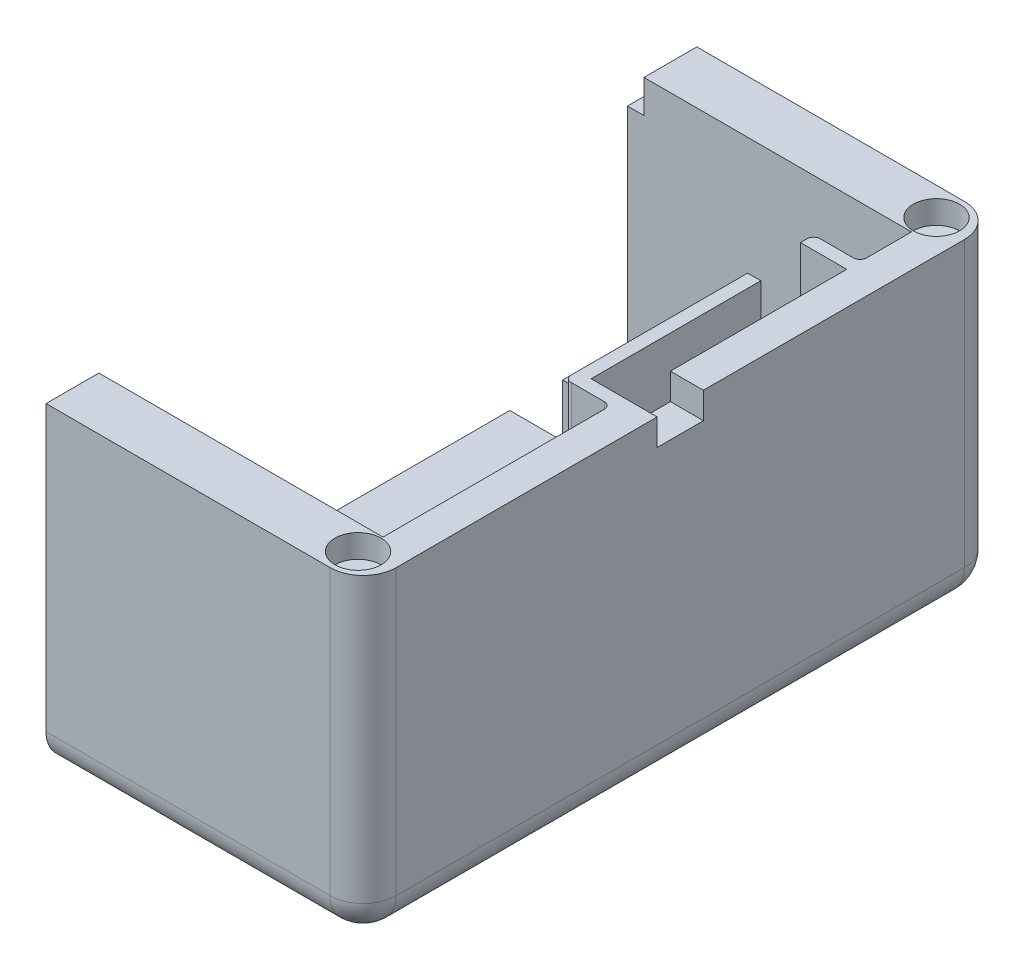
SolidWorks part; units mm, degrees
ref_plane "Piano frontale" through (0, 0, 0) normal (0, 0, 1) x (1, 0, 0)
ref_plane "Piano superiore" through (0, 0, 0) normal (0, 1, 0) x (1, 0, 0)
ref_plane "Piano destro" through (0, 0, 0) normal (1, 0, 0) x (0, 0, -1)
sketch "Sketch1" plane through (0, 0, 0) normal (0, 0, 1) x (1, 0, 0)
  line L1 (-22.553, -8.75) -> (25.447, -8.75)
  line L2 (-22.553, -8.75) -> (-22.553, 39.25)
  line L3 (-22.553, 39.25) -> (25.447, 39.25)
  line L4 (25.447, -8.75) -> (25.447, 39.25)
  dimension "D1" = 48
  dimension "D2" = 48
extrude "Boss-Extrude1" add sketch "Sketch1" along normal blind 8
sketch "Sketch2" plane through (0, 0, 8) normal (0, 0, 1) x (1, 0, 0)
  line L0 (-22.553, -8.75) -> (25.447, -8.75) construction
  line L1 (-22.553, -8.75) -> (25.447, -8.75)
  line L2 (-22.553, -8.75) -> (-22.553, -3.75)
  line L3 (-22.553, -3.75) -> (20.447, -3.75)
  line L4 (25.447, -8.75) -> (25.447, -3.75)
  line L5 (-22.553, 39.25) -> (-22.553, -8.75) construction
  line L6 (25.447, -8.75) -> (25.447, 39.25) construction
  line L7 (25.447, 39.25) -> (25.447, -3.75)
  line L9 (20.447, -3.75) -> (20.447, 39.25)
  line L10 (25.447, 39.25) -> (-22.553, 39.25) construction
  line L11 (20.447, 39.25) -> (25.447, 39.25)
  dimension "D1" = 5
  dimension "D2" = 5
extrude "Boss-Extrude2" add sketch "Sketch2" along normal blind 80
sketch "Sketch3" plane through (0, 0, 88) normal (0, 0, 1) x (1, 0, 0)
  line L0 (25.447, 39.25) -> (20.447, 39.25) construction
  line L1 (-22.553, -8.75) -> (25.447, -8.75)
  line L2 (-22.553, -8.75) -> (-22.553, 39.25)
  line L3 (-22.553, 39.25) -> (25.447, 39.25)
  line L4 (25.447, -8.75) -> (25.447, 39.25)
extrude "Boss-Extrude3" add sketch "Sketch3" along normal blind 8
fillet "Fillet1" radius 5 5 edges at (1.447, -8.75, 96) (25.447, -8.75, 48) (1.447, -8.75, 0) (25.447, 15.25, 96) (25.447, 15.25, 0)
sketch "Sketch4" plane through (25.447, 0, 0) normal (1, 0, 0) x (0, 0, -1)
  line L0 (-91, 39.25) -> (-5, 39.25) construction
  line L2 (-44.5, 39.25) -> (-51.5, 39.25)
  line L3 (-44.5, 39.25) -> (-44.5, 35.25)
  line L4 (-44.5, 35.25) -> (-51.5, 35.25)
  line L5 (-51.5, 39.25) -> (-51.5, 35.25)
  point P0 (-48, 39.25)
  dimension "D1" = 3.5
  dimension "D2" = 7
  dimension "D3" = 4
extrude "Cut-Extrude1" cut sketch "Sketch4" against normal blind 10
sketch "Sketch5" plane through (20.447, 0, 0) normal (-1, 0, 0) x (0, 0, 1)
  line L0 (51.5, 35.25) -> (44.5, 35.25) construction
  line L1 (48, 35.25) -> (48, 43.0761) construction
  line L2 (48, 43.0761) -> (48, 66.4757) construction
  line L3 (51.5, 39.25) -> (32.7393, 39.25) construction
  line L4 (88, 39.25) -> (51.5, 39.25) construction
  line L5 (44.5, 39.25) -> (8, 39.25) construction
  line L6 (51.5, 39.25) -> (51.5, 35.25) construction
  line L7 (51.5, 39.25) -> (17.8063, 39.25)
  line L8 (51.5, 39.25) -> (51.5, 30.25)
  line L9 (51.5, 30.25) -> (17.8063, 30.25)
  line L10 (17.8063, 39.25) -> (17.8063, 30.25)
  line L11 (53.5, 28.25) -> (15.8063, 28.25)
  line L12 (53.5, 28.25) -> (53.5, 39.25)
  line L13 (17.8063, 39.25) -> (15.8063, 39.25)
  line L14 (15.8063, 39.25) -> (15.8063, 28.25)
  line L15 (53.5, 41.25) -> (15.8063, 41.25) construction
  line L16 (53.5, 41.25) -> (53.5, 28.25) construction
  line L17 (15.8063, 41.25) -> (15.8063, 28.25) construction
  line L18 (51.5, 39.25) -> (53.5, 39.25)
  point P0 (48, 35.25)
  point P12 (48, 39.25)
  dimension "D1" = 9
  dimension "D2" = 0
  dimension "D3" = 2
extrude "Boss-Extrude4" add sketch "Sketch5" along normal blind 7 contours L14 L11 L12 L8 L9 L10 M6 M10 M11
sketch "Sketch6" plane through (0, 30.25, 0) normal (0, 1, 0) x (1, 0, 0)
  line L0 (13.447, -51.5) -> (20.447, -51.5) construction
  line L1 (13.447, -51.5) -> (15.447, -51.5)
  line L2 (13.447, -51.5) -> (13.447, -17.8063)
  line L3 (13.447, -17.8063) -> (15.447, -17.8063)
  line L4 (15.447, -51.5) -> (15.447, -17.8063)
  line L5 (13.447, -51.5) -> (13.447, -17.8063) construction
  line L6 (13.447, -17.8063) -> (20.447, -17.8063) construction
  dimension "D1" = 2
extrude "Boss-Extrude5" add sketch "Sketch6" along normal blind 9
sketch "Sketch8" plane through (13.447, 0, 0) normal (-1, 0, 0) x (0, 0, 1)
  line L0 (53.5, 39.25) -> (15.8063, 39.25) construction
  line L1 (17.8063, 39.25) -> (25.8063, 39.25)
  line L2 (53.5, 28.25) -> (15.8063, 28.25) construction
  line L3 (25.8063, 39.25) -> (17.8063, 39.25)
  line L4 (25.8063, 39.25) -> (25.8063, 30.25)
  line L7 (25.8063, 30.25) -> (17.8063, 30.25)
  line L8 (17.8063, 39.25) -> (17.8063, 30.25)
  dimension "D1" = 2
extrude "Cut-Extrude2" cut sketch "Sketch8" against normal blind 5 contours L8 L7 L4 M5
ref_plane "Plane3" through (8.3485, 8.3485, 0) normal (0.7071, 0.7071, 0) x (0.7071, -0.7071, 0)
mirror "Mirror1" about plane through (8.3485, 8.3485, 0) normal (0.7071, 0.7071, 0) of "Cut-Extrude2", "Boss-Extrude5", "Boss-Extrude4", "Cut-Extrude1"
sketch "Sketch12" plane through (0, 39.25, 0) normal (0, 1, 0) x (1, 0, 0)
  line L0 (20.447, -96) -> (20.447, -87.7702) construction
  line L1 (20.447, -88) -> (20.447, -53.5) construction
  circle A0 centre (20.447, -91.7702) radius 3.5
  dimension "D1" = 7
  dimension "D2" = 0
  dimension "D3" = 4
extrude "Cut-Extrude9" cut sketch "Sketch12" against normal blind 3.5
mirror "Mirror2" about plane through (8.3485, 8.3485, 0) normal (0.7071, 0.7071, 0) of "Cut-Extrude9"
ref_plane "Plane5" through (0, 0, 48) normal (0, 0, 1) x (1, 0, 0)
mirror "Mirror3" about plane through (0, 0, 48) normal (0, 0, 1) of "Mirror2", "Cut-Extrude9"
sketch "Sketch13" plane through (0, 0, 0) normal (0, 0, -1) x (-1, 0, 0)
  line L1 (20.053, 39.25) -> (22.553, 39.25)
  line L2 (20.053, 39.25) -> (20.053, 34.25)
  line L3 (20.053, 34.25) -> (22.553, 34.25)
  line L4 (22.553, 39.25) -> (22.553, 34.25)
  line L6 (-20.447, 39.25) -> (22.553, 39.25) construction
extrude "Cut-Extrude10" cut sketch "Sketch13" against normal blind 10
extrude "Cut-Extrude12" cut sketch "Sketch16" along normal mid plane 45
sketch "Sketch16" plane through (50.7854, 4.5827, 79.35) normal (0, 0, -1) x (-1, 0, 0)
  circle A0 centre (55.7284, 7.4873) radius 1.59
sketch "Sketch17" plane through (0, 0, 88) normal (0, 0, -1) x (-1, 0, 0)
  circle A0 centre (4.943, 12.07) radius 1.59
  circle A2 centre (4.943, 12.07) radius 1.59 construction
  dimension "D1" = 0
extrude "Boss-Extrude6" add sketch "Sketch17" along normal blind 5 and the other way blind 5
sketch "Sketch18" plane through (0, 0, 83) normal (0, 0, -1) x (-1, 0, 0)
  circle A0 centre (4.943, 12.07) radius 2.5
  dimension "D1" = 5
extrude "Boss-Extrude7" add sketch "Sketch18" along normal blind 2 and the other way blind 5
sketch "Sketch19" plane through (0, 0, 81) normal (0, 0, -1) x (-1, 0, 0)
  circle A0 centre (4.943, 12.07) radius 1.75
  circle A1 centre (4.943, 12.07) radius 2.5 construction
  dimension "D1" = 0
  dimension "D2" = 3.5
extrude "Cut-Extrude13" cut sketch "Sketch19" against normal blind 3
fillet "Fillet2" radius 1 7 edges at (-17.053, -3.75, 15.8063) (-17.053, 3.25, 15.8063) (-11.553, -0.25, 15.8063) (-11.553, 3.25, 34.6531) (-11.553, -3.75, 34.6531) (-17.053, -3.75, 53.5) (-17.053, 3.25, 53.5)
fillet "Fillet3" radius 1 7 edges at (20.447, 33.75, 15.8063) (13.447, 33.75, 15.8063) (20.447, 28.25, 34.6531) (13.447, 28.25, 34.6531) (13.447, 33.75, 53.5) (16.947, 28.25, 53.5) (20.447, 33.75, 53.5)
sketch "Sketch21" plane through (0, 0, 96) normal (0, 0, 1) x (1, 0, 0)
  circle A0 centre (-4.943, 12.07) radius 1.59
extrude "Boss-Extrude8" add sketch "Sketch21" against normal up to next
equation "\"ir_lenght\"= 5"
equation "\"ir_width\"= 10"
equation "\"D2@Sketch13\"= \"ir_width\" / 2"
equation "\"D3@Sketch13\"=\"ir_lenght\"/2"
